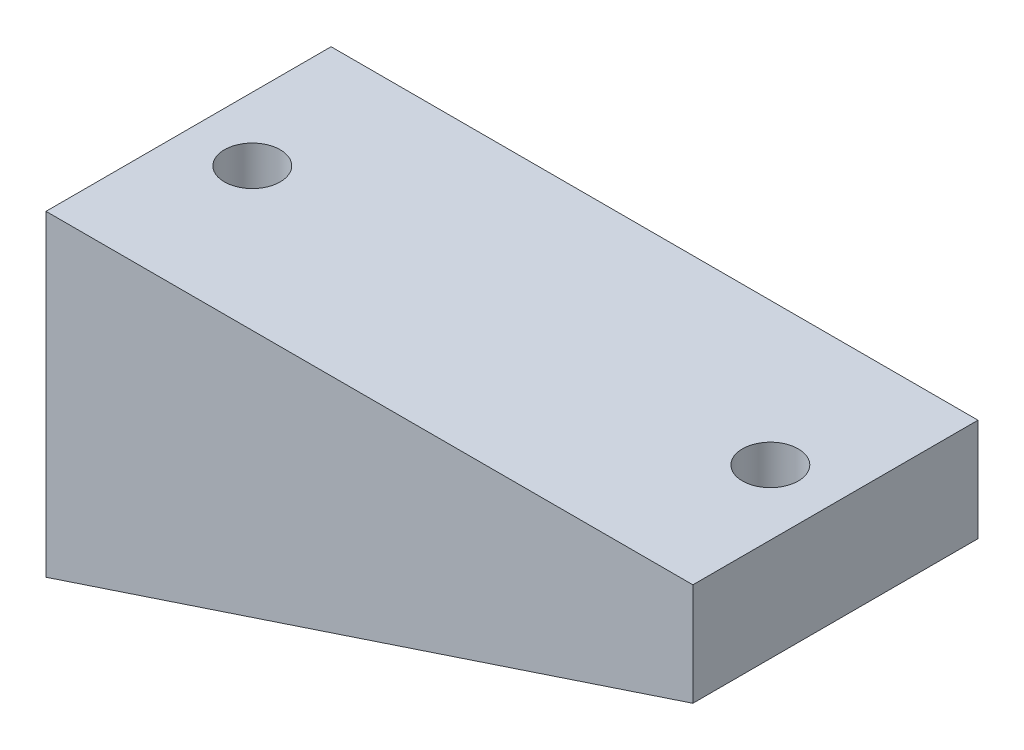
SolidWorks part; units mm, degrees
ref_plane "Front" through (0, 0, 0) normal (0, 0, 1) x (1, 0, 0)
ref_plane "Top" through (0, 0, 0) normal (0, 1, 0) x (1, 0, 0)
ref_plane "Right" through (0, 0, 0) normal (1, 0, 0) x (0, 0, -1)
sketch "Sketch1" plane through (0, 0, 0) normal (0, 0, 1) x (1, 0, 0)
  line L0 (0, 0) -> (120.2505, 39.8341)
  line L1 (120.2505, 39.8341) -> (120.2505, 58.9096)
  line L2 (120.2505, 58.9096) -> (0, 58.9096)
  line L3 (0, 58.9096) -> (0, 0)
extrude "Extrude1" add sketch "Sketch1" along normal mid plane 53
sketch "Sketch2" plane through (0, 58.9096, 0) normal (0, 1, 0) x (-1, 0, 0)
  circle A0 centre (-108.1503, 0) radius 5.1871
extrude "Cut-Extrude1" cut sketch "Sketch2" against normal offset from surface (47.9989 mm away) 5
ref_plane "Plane1" through (60, 0, 0) normal (1, 0, 0) x (0, 0, -1)
mirror "Mirror1" about plane through (60, 0, 0) normal (1, 0, 0) of "Cut-Extrude1"
